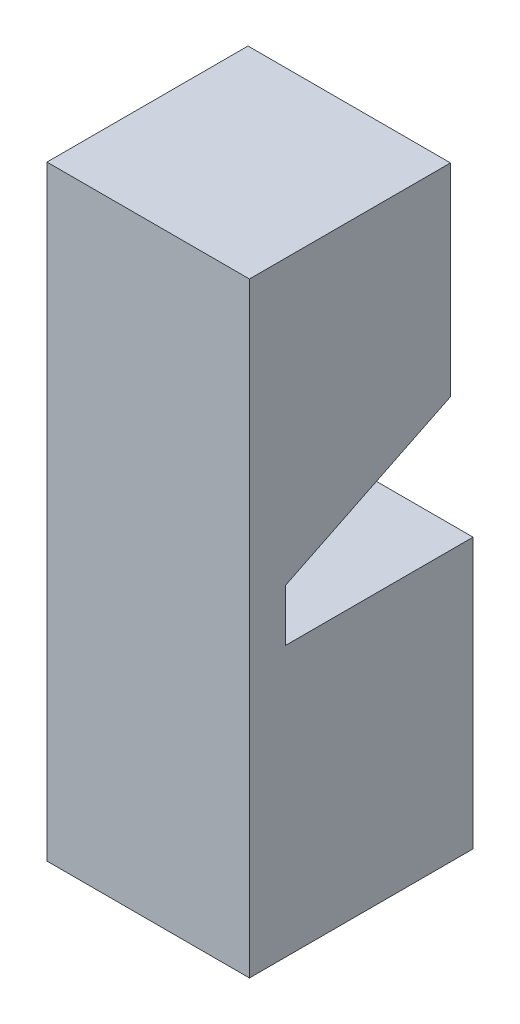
SolidWorks part; units mm, degrees
ref_plane "Front Plane" through (0, 0, 0) normal (0, 0, 1) x (1, 0, 0)
ref_plane "Top Plane" through (0, 0, 0) normal (0, 1, 0) x (1, 0, 0)
ref_plane "Right Plane" through (0, 0, 0) normal (1, 0, 0) x (0, 0, -1)
sketch "Sketch1" plane through (0, 0, 0) normal (1, 0, 0) x (0, 0, -1)
  line L0 (108.9639, 969.6522) -> (605.1894, 1212.85)
  line L1 (0, 0) -> (673.1, 0)
  line L3 (108.9639, 812.8) -> (673.1, 812.8)
  line L4 (673.1, 0) -> (673.1, 812.8)
  line L6 (0, 0) -> (0, 1822.45)
  line L7 (0, 1822.45) -> (605.1894, 1822.45)
  line L8 (605.1894, 1212.85) -> (605.1894, 1822.45)
  line L9 (108.9639, 812.8) -> (108.9639, 969.6522)
  dimension "D1" = 1822.45
  dimension "D2" = 673.1
  dimension "D3" = 812.8
  dimension "D4" = 609.6
extrude "Boss-Extrude1" add sketch "Sketch1" along normal blind 609.6
